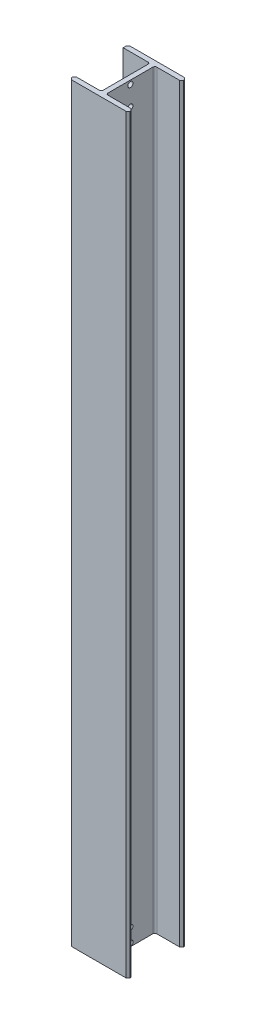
SolidWorks part; units mm, degrees
ref_plane "Front Plane" through (0, 0, 0) normal (0, 0, 1) x (1, 0, 0)
ref_plane "Top Plane" through (0, 0, 0) normal (0, 1, 0) x (1, 0, 0)
ref_plane "Right Plane" through (0, 0, 0) normal (1, 0, 0) x (0, 0, -1)
sketch "Sketch1" plane through (0, 0, 0) normal (0, 1, 0) x (1, 0, 0)
  line L0 (0, 0) -> (-41.275, 0)
  line L1 (-41.275, 0) -> (-41.275, -6.35)
  line L2 (-41.275, -6.35) -> (-6.35, -6.35)
  line L3 (-6.35, -6.35) -> (-6.35, -69.85)
  line L4 (-6.35, -69.85) -> (-41.275, -69.85)
  line L5 (-41.275, -69.85) -> (-41.275, -76.2)
  line L6 (-41.275, -76.2) -> (34.925, -76.2)
  line L7 (34.925, -76.2) -> (34.925, -69.85)
  line L8 (34.925, -69.85) -> (0, -69.85)
  line L9 (0, -69.85) -> (0, -6.35)
  line L10 (0, -6.35) -> (34.925, -6.35)
  line L11 (34.925, -6.35) -> (34.925, 0)
  line L12 (34.925, 0) -> (0, 0)
  dimension "D1" = 76.2
  dimension "D2" = 76.2
  dimension "D3" = 34.925
  dimension "D4" = 34.925
  dimension "D5" = 6.35
  dimension "D6" = 6.35
  dimension "D7" = 6.35
  dimension "D8" = 6.35
  dimension "D9" = 76.2
extrude "Extrude1" add sketch "Sketch1" along normal blind 977.9
fillet "Fillet1" radius 2.54 4 edges at (-6.35, 488.95, 6.35) (-6.35, 488.95, 69.85) (0, 488.95, 69.85) (0, 488.95, 6.35)
chamfer "Chamfer1" distance 2.54 angle 45 7 edges at (34.925, 488.95, 76.2) (34.925, 488.95, 69.85) (34.925, 488.95, 6.35) (34.925, 488.95, 0) (-41.275, 488.95, 0) (-41.275, 488.95, 69.85) (-41.275, 488.95, 76.2)
sketch "Sketch2" plane through (0, 0, 76.2) normal (0, 0, 1) x (1, 0, 0)
  line L0 (0, 977.9) -> (48.1946, 925.0644)
  line L2 (-6.35, 977.9) -> (-54.5446, 929.7054)
  line L3 (-54.5446, 929.7054) -> (-54.5446, 1006.7284)
  line L4 (-54.5446, 1006.7284) -> (-5.873, 1006.7284)
  line L6 (48.1946, 925.0644) -> (48.1946, 1006.7284)
  line L7 (-5.873, 1006.7284) -> (-6.35, 1006.7284)
  line L8 (-6.35, 1006.7284) -> (-6.35, 977.9)
  line L9 (0, 1006.7284) -> (48.1946, 1006.7284)
  line L10 (0, 977.9) -> (0, 1006.7284)
  line L11 (-41.275, 0) -> (-41.275, 977.9) construction
  line L12 (-38.735, 977.9) -> (32.385, 977.9) construction
  dimension "D1" = 6.35
  dimension "D2" = 45
  dimension "D3" = 34.925
extrude "Cut-Extrude1" [suppressed] cut sketch "Sketch2" against normal blind 7.62
sketch "Sketch3" plane through (0, 0, 0) normal (1, 0, 0) x (0, 0, -1)
  line L0 (-67.31, 977.9) -> (-8.89, 977.9) construction
  line L1 (-67.31, 0) -> (-8.89, 0) construction
  line L2 (-76.2, 0) -> (-76.2, 977.9) construction
  circle A0 centre (-38.1, 972.82) radius 3.3782
  circle A1 centre (-38.1, 947.42) radius 3.3782
  circle A2 centre (-38.1, 3.81) radius 3.3782
  circle A3 centre (-38.1, 21.59) radius 3.3782
  dimension "D1" = 6.7564
  dimension "D2" = 6.7564
  dimension "D4" = 25.4
  dimension "D5" = 6.7564
  dimension "D6" = 6.7564
  dimension "D7" = 17.78
  dimension "D8" = 3.81
  dimension "D3" = 5.08
  dimension "D9" = 38.1
extrude "Cut-Extrude2" cut sketch "Sketch3" against normal through all
